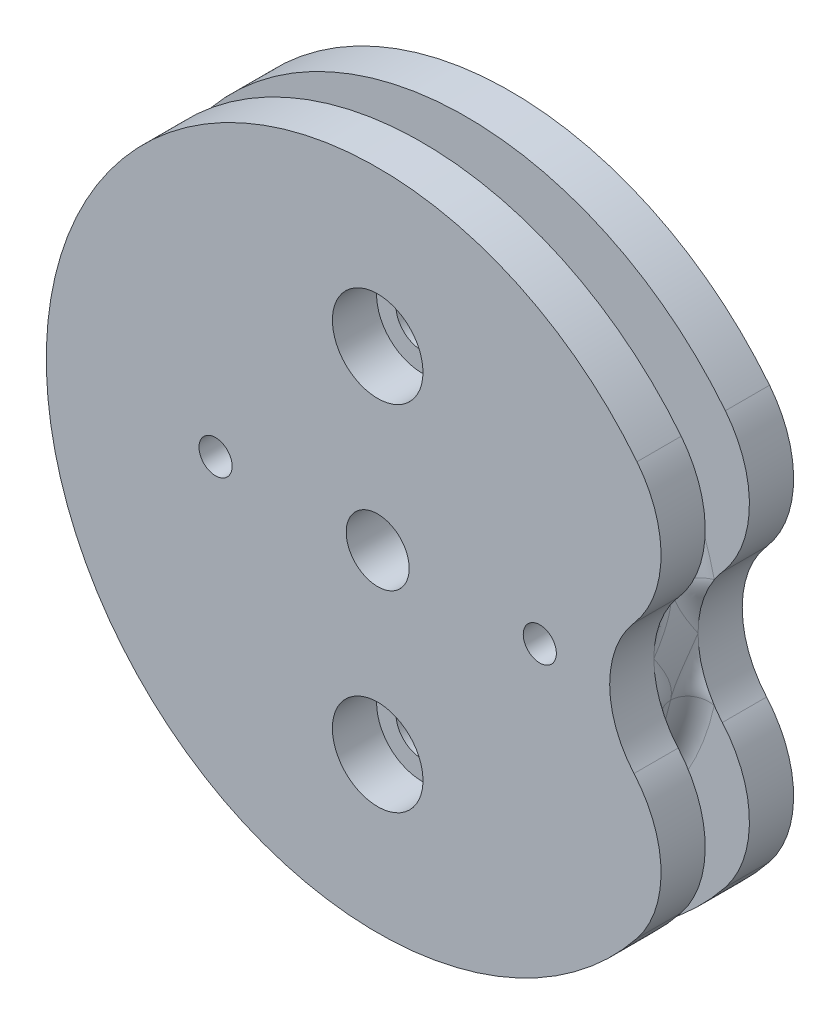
SolidWorks part; units mm, degrees
ref_plane "Front Plane" through (0, 0, 0) normal (0, 0, 1) x (1, 0, 0)
ref_plane "Top Plane" through (0, 0, 0) normal (0, 1, 0) x (1, 0, 0)
ref_plane "Right Plane" through (0, 0, 0) normal (1, 0, 0) x (0, 0, -1)
sketch "Sketch1" plane through (0, 0, 0) normal (0, 0, 1) x (1, 0, 0)
  line L0 (0, 15) -> (0, -15) construction
  line L1 (0, 0) -> (-15, 0) construction
  circle A0 centre (0, 0) radius 15
  circle A1 centre (0, 0) radius 4.175
  circle A2 centre (0, 8) radius 2.05
  circle A3 centre (0, -8) radius 2.05
  point P24 (0, 0)
  dimension "D1" = 30
  dimension "D2" = 8.35
  dimension "D3" = 4.1
  dimension "D4" = 8
extrude "Main Body" add sketch "Sketch1" along normal mid plane 6
sketch "Sketch2" plane through (0, 0, 3) normal (0, 0, 1) x (1, 0, 0)
  circle A0 centre (0, 0) radius 4.175 construction
  circle A1 centre (0, 0) radius 4.175
  circle A2 centre (0, 0) radius 1.425
  dimension "D1" = 2.85
extrude "Main Bolt Surface" add sketch "Sketch2" against normal offset from surface (3.15 mm away) 2.85
sketch "Sketch4" plane through (0, 0, 0) normal (0, 0, 1) x (1, 0, 0)
  circle A0 centre (0, 0) radius 15 construction
  circle A1 centre (0, 0) radius 15
  circle A2 centre (0, 0) radius 10.5
  circle A3 centre (0, 8) radius 2.05 construction
  circle A4 centre (0, 8) radius 2.05 construction
  dimension "D1" = 21
extrude "Pulley Slot" cut sketch "Sketch4" against normal mid plane 2
sketch "Sketch5" plane through (0, 0, -3) normal (0, 0, -1) x (-1, 0, 0)
  line L0 (0, 0) -> (15, 0) construction
  circle A1 centre (0, 8) radius 2.05 construction
  circle A8 centre (0, 0) radius 15 construction
  circle A9 centre (0, 8) radius 2.05
  circle A10 centre (0, -8) radius 1.175
  circle A11 centre (0, -8) radius 2.05
  circle A16 centre (0, 8) radius 1.175
  dimension "D1" = 2.35
extrude "Support Bolt Surface" add sketch "Sketch5" against normal offset from surface (4 mm away) 2
sketch "Sketch6" plane through (0, 0, 3) normal (0, 0, 1) x (1, 0, 0)
  line L0 (0, 15) -> (0, -15) construction
  line L1 (0, 0) -> (15, 0) construction
  circle A0 centre (0, 0) radius 15 construction
  circle A1 centre (15, 0) radius 4.5
  circle A3 centre (0, 0) radius 10.5 construction
extrude "Tendon Anchor Clearance" cut sketch "Sketch6" against normal through all
fillet "Inner Contouring" radius 1 2 edges at (10.5, 0, -1) (10.5, 0, 1)
sketch "Sketch8" plane through (0, 0, -3) normal (0, 0, -1) x (-1, 0, 0)
  line L0 (-4.175, 0) -> (-10.5, 0) construction
  line L1 (0, 0) -> (0, 15) construction
  circle A2 centre (0, 0) radius 4.175 construction
  arc A3 (-14.325, -4.4491) -> (-14.325, 4.4491) centre (-15, 0) ccw construction
  circle A4 centre (-7.3375, 0) radius 0.75
  circle A5 centre (7.3375, 0) radius 0.75
  dimension "D1" = 1.5
extrude "Tendon Anchor" cut sketch "Sketch8" against normal through all
fillet "Contouring" radius 5 4 edges at (14.325, -4.4491, 2) (14.325, 4.4491, 2) (14.325, -4.4491, -2) (14.325, 4.4491, -2)
ref_point "Ref Center"
equation "\"D2@Sketch1\"=8+\"print free@values@params.sldprt\""
equation "\"D3@Sketch1\"=3.75+\"print free@values@params.sldprt\""
equation "\"D1@Sketch5\"=2+\"print free@values@params.sldprt\""
equation "\"D1@Sketch2\"=2.5+\"print free@values@params.sldprt\""
equation "\"D1@Sketch8\"=\"width keep@values@params.sldprt\"/2"
